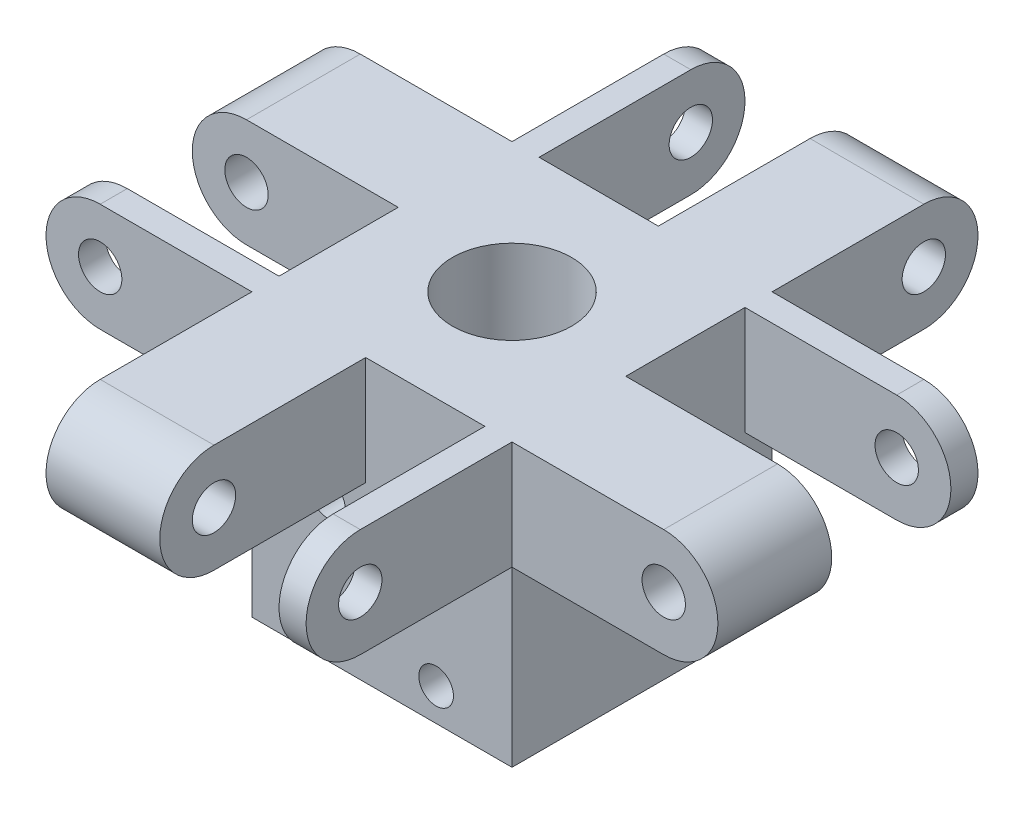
SolidWorks part; units mm, degrees
ref_plane "前视基准面" through (0, 0, 0) normal (0, 0, 1) x (1, 0, 0)
ref_plane "上视基准面" through (0, 0, 0) normal (0, 1, 0) x (1, 0, 0)
ref_plane "右视基准面" through (0, 0, 0) normal (1, 0, 0) x (0, 0, -1)
sketch "草图1" plane through (0, 0, 0) normal (0, 1, 0) x (1, 0, 0)
  line L1 (-9, -9) -> (9, -9)
  line L2 (-9, -9) -> (-9, 9)
  line L3 (-9, 9) -> (9, 9)
  line L4 (9, -9) -> (9, 9)
  line L5 (-9, -9) -> (9, 9) construction
  line L6 (-9, 9) -> (9, -9) construction
  line L7 (-12, -12) -> (12, -12)
  line L8 (-12, -12) -> (-12, 12)
  line L9 (-12, 12) -> (12, 12)
  line L10 (12, -12) -> (12, 12)
  line L11 (-12, -12) -> (12, 12) construction
  line L12 (-12, 12) -> (12, -12) construction
  point P0 (0, 0)
  point P6 (0, 0)
  dimension "D1" = 18
  dimension "D2" = 18
  dimension "D3" = 24
  dimension "D4" = 24
extrude "凸台-拉伸1" add sketch "草图1" along normal blind 26
hole_wizard "Ø3.2 (3.2) 直径孔1" positions "草图2" profile "草图3" hole size "Ø3.2" standard "GB"
sketch "草图2" plane through (0, 0, 12) normal (0, 0, 1) x (1, 0, 0)
  line L0 (0, 26) -> (0, 0) construction
  line L1 (-12, 26) -> (12, 26) construction
  line L3 (-12, 8) -> (12, 8) construction
  line L4 (-12, 26) -> (-12, 0) construction
  line L5 (12, 26) -> (12, 0) construction
  line L7 (-12, 0) -> (12, 0) construction
  point P17 (-5, 13)
  point P21 (5, 13)
  point P23 (5, 3)
  point P24 (-5, 3)
  dimension "D1" = 8
  dimension "D2" = 10
  dimension "D3" = 10
sketch "草图3" plane through (-5, 3, 12) normal (1, 0, 0) x (0, -1, 0)
  line L0 (0, 0) -> (0, 24)
  line L1 (0, 24) -> (1.6, 24)
  line L2 (1.6, 24) -> (1.6, 0)
  line L5 (1.6, 0) -> (0, 0)
  line L11 (0, -6.35) -> (0, 107.95) construction
  dimension "通孔孔直径" = 3.2
  dimension "通孔孔深度" = 24
sketch "草图5" plane through (-12, 0, 0) normal (-1, 0, 0) x (0, 0, 1)
  line L0 (12, 26) -> (26, 26)
  line L1 (26, 16) -> (12, 16)
  line L2 (12, 26) -> (12, 0) construction
  line L3 (12, 26) -> (12, 16)
  arc A0 (26, 26) -> (26, 16) centre (26, 21) cw
  circle A1 centre (26, 21) radius 2
  dimension "D1" = 5
  dimension "D3" = 4
  dimension "D2" = 14
extrude "凸台-拉伸2" add sketch "草图5" against normal blind 24
sketch "草图7" plane through (0, 0, 0) normal (0, 0, 1) x (1, 0, 0)
  line L2 (0, 0) -> (0, 31.068)
pattern_circular "阵列(圆周)1" count 4 over 360 about axis through (0, 0, 0) along (0, 1, 0) of "凸台-拉伸2"
sketch "草图8" plane through (0, 26, 0) normal (0, 1, 0) x (1, 0, 0)
  line L0 (-12, -12) -> (-12, -26) construction
  line L3 (-1.5, -12) -> (-1.5, -31)
  line L4 (-1.5, -31) -> (9.5, -31)
  line L5 (9.5, -31) -> (9.5, -12)
  line L9 (9.5, -12) -> (-1.5, -12)
  line L10 (26, -12) -> (12, -12) construction
  point P17 (0, 0)
  point P18 (0, 0)
  dimension "D1" = 11
  dimension "D2" = 19
  dimension "D3" = 10.5
extrude "切除-拉伸2" cut sketch "草图8" against normal blind 22 contours L9 L3 L4 L5
pattern_circular "阵列(圆周)2" count 4 over 360 about axis through (0, 0, 0) along (0, 1, 0) of "切除-拉伸2"
sketch "草图9" plane through (0, 26, 0) normal (0, 1, 0) x (1, 0, 0)
  line L1 (-9, -9) -> (9, -9)
  line L2 (-9, -9) -> (-9, 9)
  line L3 (-9, 9) -> (9, 9)
  line L4 (9, -9) -> (9, 9)
  line L5 (-9, -9) -> (9, 9) construction
  line L6 (-9, 9) -> (9, -9) construction
  circle A0 centre (0, 0) radius 5.5
  point P0 (0, 0)
  dimension "D1" = 11
extrude "凸台-拉伸3" add sketch "草图9" against normal blind 9
